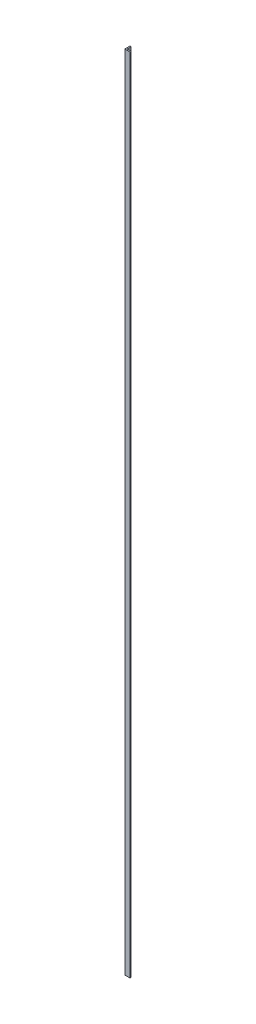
SolidWorks part; units mm, degrees
ref_plane "FACE" through (0, 0, 0) normal (0, 0, 1) x (1, 0, 0)
ref_plane "DESSUS" through (0, 0, 0) normal (0, 1, 0) x (1, 0, 0)
ref_plane "DROITE" through (0, 0, 0) normal (1, 0, 0) x (0, 0, -1)
sketch "Esquisse2" plane through (0, 0, 0) normal (0, 1, 0) x (1, 0, 0)
  line L0 (0, 13) -> (0, 0)
  line L1 (0, 0) -> (13, 0)
  line L2 (13, 0) -> (13, 3)
  line L3 (13, 3) -> (4.5, 3)
  line L4 (3, 4.5) -> (3, 13)
  line L5 (3, 13) -> (0, 13)
  arc A0 (4.5, 3) -> (3, 4.5) centre (4.5, 4.5) cw
  dimension "D1" = 13
  dimension "D4" = 1.5
  dimension "D2" = 3
  dimension "D3" = 3
  dimension "D5" = 13
extrude "Boss.-Extru.1" add sketch "Esquisse2" along normal blind 2017
